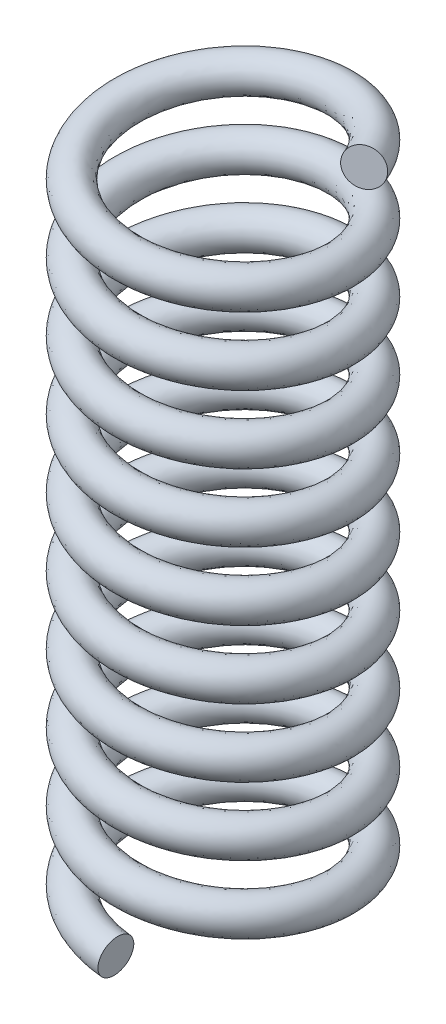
SolidWorks part; units mm, degrees
ref_plane "Front Plane" through (0, 0, 0) normal (0, 0, 1) x (1, 0, 0)
ref_plane "Top Plane" through (0, 0, 0) normal (0, 1, 0) x (1, 0, 0)
ref_plane "Right Plane" through (0, 0, 0) normal (1, 0, 0) x (0, 0, -1)
sketch "Sketch1" plane through (0, 0, 0) normal (0, 1, 0) x (1, 0, 0)
  circle A0 centre (0, 0) radius 30
  dimension "D1" = 60
curve "Helix/Spiral1"
ref_plane "Plane3" through (27.4732, 184, -12.0509) normal (0.3997, 0.1003, 0.9112) x (0.8798, -0.321, -0.3506)
sketch "Sketch5" plane through (27.4732, 184, -12.0509) normal (0.3997, 0.1003, 0.9112) x (0.8798, -0.321, -0.3506)
  circle A0 centre (0, 0) radius 5
  dimension "D1" = 10
sweep "Sweep2" add profiles "Sketch5" path "Helix/Spiral1"
